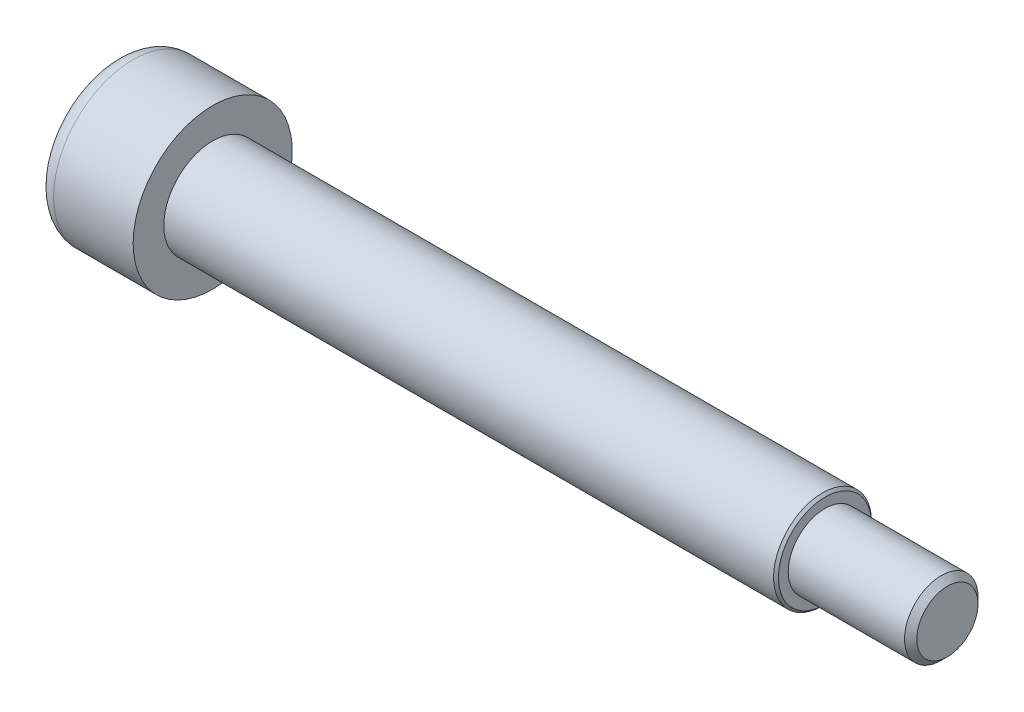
SolidWorks part; units mm, degrees
ref_plane "Face" through (0, 0, 0) normal (0, 0, 1) x (1, 0, 0)
ref_plane "Dessus" through (0, 0, 0) normal (0, 1, 0) x (1, 0, 0)
ref_plane "Droite" through (0, 0, 0) normal (1, 0, 0) x (0, 0, -1)
sketch "Esquisse1" plane through (0, 0, 0) normal (0, 0, 1) x (1, 0, 0)
  line L0 (0, 0) -> (66.365, 0) construction
  line L1 (60, 0) -> (60, -3)
  line L2 (60, -3) -> (50, -3)
  line L3 (0, -4) -> (0, -6.5)
  line L4 (0, -6.5) -> (-8, -6.5)
  line L5 (-8, -6.5) -> (-8, 0)
  line L6 (-8, 0) -> (60, 0)
  line L7 (50, -3) -> (50, -4)
  line L8 (50, -4) -> (0, -4)
  dimension "D1" = 8
  dimension "D2" = 6.5
  dimension "D3" = 50
  dimension "D4" = 3
  dimension "D5" = 10
  dimension "D6" = 4
revolve "Base-Révolution" add sketch "Esquisse1" angle 360 about L0
chamfer "Chanfrein1" distance 0.5 angle 45 1 edges at (60, 0, 3)
fillet "Congé1" radius 1.5 1 edges at (-8, 0, 6.5)
chamfer "Chanfrein2" distance 0.2 angle 45 1 edges at (50, 0, 4)
